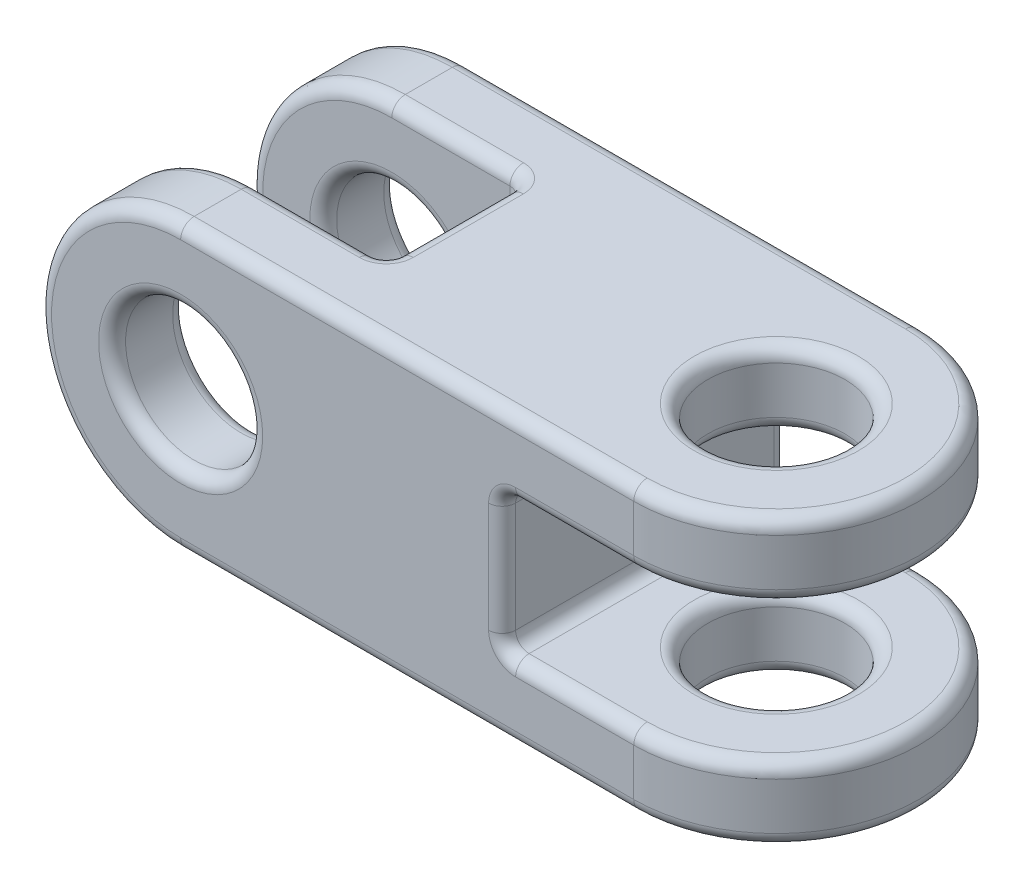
SolidWorks part; units mm, degrees
ref_plane "Front Plane" through (0, 0, 0) normal (0, 0, 1) x (1, 0, 0)
ref_plane "Top Plane" through (0, 0, 0) normal (0, 1, 0) x (1, 0, 0)
ref_plane "Right Plane" through (0, 0, 0) normal (1, 0, 0) x (0, 0, -1)
sketch "Sketch1" plane through (0, 0, 0) normal (0, 0, 1) x (1, 0, 0)
  line L1 (0, 8.5852) -> (0, -8.5852) construction
  line L9 (0, -8.5852) -> (13.6398, -8.5852)
  line L10 (13.6398, -8.5852) -> (13.6398, 8.5852)
  line L11 (13.6398, 8.5852) -> (0, 8.5852)
  arc A0 (0, 8.5852) -> (0, -8.5852) centre (0, 0) ccw
  circle A1 centre (0, 0) radius 4.1275
  dimension "D3" = 8.255
  dimension "D1" = 17.1704
  dimension "D2" = 22.225
extrude "Extrude1" add sketch "Sketch1" along normal mid plane 17.1704
sketch "Sketch4" plane through (0, 8.5852, 0) normal (0, 1, 0) x (-1, 0, 0)
  line L0 (0, 0) -> (14.7841, 0) construction
  line L1 (8.5852, -4.1275) -> (8.5852, 4.1275)
  line L3 (8.5852, -4.1275) -> (-7.9248, -4.1275)
  line L4 (8.5852, 4.1275) -> (-7.9248, 4.1275)
  line L5 (-7.9248, -4.1275) -> (-7.9248, 4.1275)
  line L6 (8.5852, -8.5852) -> (8.5852, 8.5852) construction
  point P8 (8.5852, 0)
  point P11 (-7.9248, 0)
  dimension "D1" = 8.255
  dimension "D2" = 16.51
extrude "Cut-Extrude2" cut sketch "Sketch4" against normal through all
sketch "Sketch5" plane through (27.2796, 0, 0) normal (0, -1, 0) x (-1, 0, 0)
  line L0 (13.6398, -8.5852) -> (13.6398, 8.5852) construction
  line L1 (0, 8.5852) -> (0, -8.5852) construction
  line L9 (0, -8.5852) -> (13.6398, -8.5852)
  line L10 (13.6398, -8.5852) -> (13.6398, 8.5852)
  line L11 (13.6398, 8.5852) -> (0, 8.5852)
  arc A0 (0, 8.5852) -> (0, -8.5852) centre (0, 0) ccw
  circle A1 centre (0, 0) radius 4.1275
extrude "Extrude2" add sketch "Sketch5" against normal mid plane 17.1704
sketch "Sketch7" plane through (27.94, 0, 0) normal (0, 0, -1) x (-1, 0, 0)
  line L0 (0, 0) -> (14.7841, 0) construction
  line L1 (8.5852, -4.1275) -> (8.5852, 4.1275)
  line L2 (-7.9248, 8.5852) -> (-7.9248, -8.5852) construction
  line L3 (8.5852, -4.1275) -> (-7.9248, -4.1275)
  line L4 (8.5852, 4.1275) -> (-7.9248, 4.1275)
  line L5 (-7.9248, -4.1275) -> (-7.9248, 4.1275)
  point P8 (8.5852, 0)
  point P11 (-7.9248, 0)
extrude "Cut-Extrude4" cut sketch "Sketch7" against normal through all and the other way through all
fillet "Fillet4" radius 0.8128 36 edges at (23.3172, -4.1275, -8.5852) (19.3548, 0, -8.5852) (23.3172, 4.1275, -8.5852) (23.3172, -4.1275, 8.5852) (19.3548, 0, 8.5852) (23.3172, 4.1275, 8.5852) (19.3548, -4.1275, 0) (19.3548, 4.1275, 0) (23.1521, 4.1275, 0) (35.8648, 4.1275, 0) (31.4071, -4.1275, 0) (35.8648, -4.1275, 0) (27.2796, -8.5852, -4.1275) (27.2796, 8.5852, -4.1275) (35.8648, 8.5852, 0) (35.8648, -8.5852, 0) (3.9624, 8.5852, -4.1275) (3.9624, 8.5852, 4.1275) (7.9248, 8.5852, 0) (3.9624, -8.5852, -4.1275) (3.9624, -8.5852, 4.1275) (7.9248, -8.5852, 0) (7.9248, 0, 4.1275) (7.9248, 0, -4.1275) (4.1275, 0, 4.1275) (-8.5852, 0, 4.1275) (-4.1275, 0, -4.1275) (-8.5852, 0, -4.1275) (4.1275, 0, -8.5852) (4.1275, 0, 8.5852) (-8.5852, 0, -8.5852) (13.6398, -8.5852, -8.5852) (13.6398, 8.5852, -8.5852) (-8.5852, 0, 8.5852) (13.6398, -8.5852, 8.5852) (13.6398, 8.5852, 8.5852)
